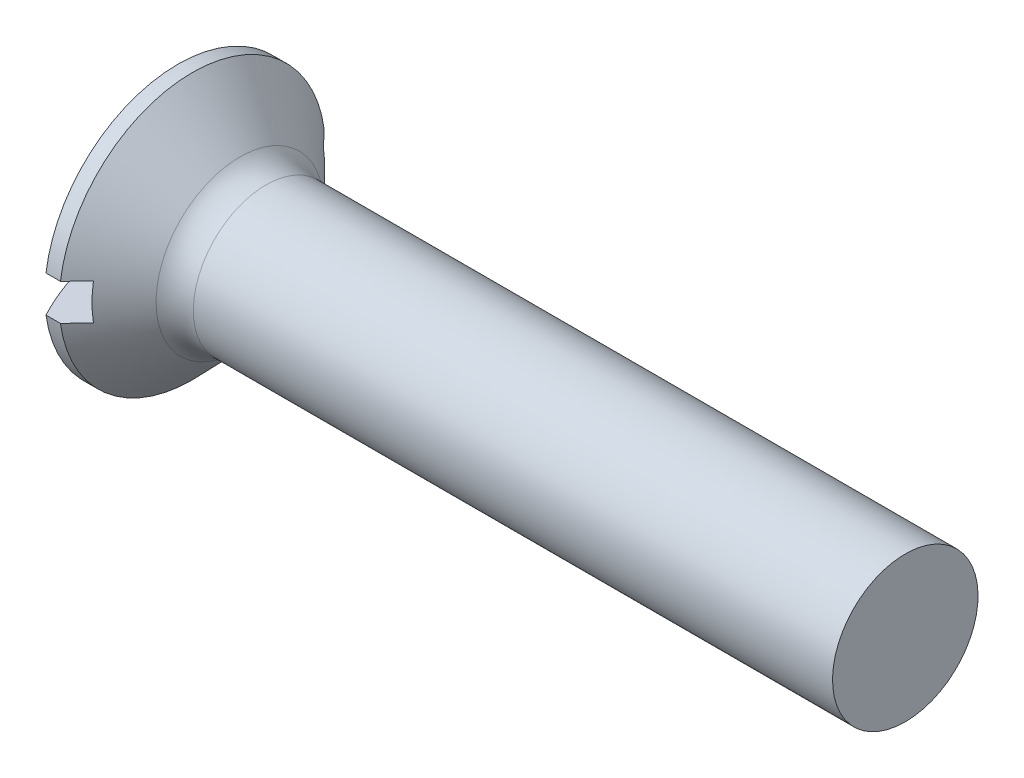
SolidWorks part; units mm, degrees
ref_plane "Front Plane" through (0, 0, 0) normal (0, 0, 1) x (1, 0, 0)
ref_plane "Top Plane" through (0, 0, 0) normal (0, 1, 0) x (1, 0, 0)
ref_plane "Right Plane" through (0, 0, 0) normal (1, 0, 0) x (0, 0, -1)
sketch "BodySke" plane through (0, 0, 0) normal (0, 0, 1) x (1, 0, 0)
  line L0 (2.3, 0) -> (111.3824, 0) construction
  line L1 (2.3, 0) -> (2.3, 9.15) construction
  line L2 (2.3, 9.15) -> (3.2924, 9.15)
  line L3 (3.2924, 9.15) -> (7.3, 5)
  line L4 (7.3, 5) -> (52.3, 5)
  line L5 (52.3, 5) -> (52.3, 0)
  line L6 (8.8, 8.824) -> (8.8, -5.8939) construction
  line L7 (2.3, 0) -> (52.3, 0)
  line L8 (14.3, 8.824) -> (14.3, -4.958) construction
  line L9 (2.3, -9.15) -> (3.2924, -9.15) construction
  line L10 (3.2924, -9.15) -> (7.3, -5) construction
  line L11 (7.3, -5) -> (52.3, -5) construction
  line L12 (2.3, 0) -> (-13.4753, 0) construction
  line L13 (0, 0) -> (0, 11.6167) construction
  line L14 (2.3, 0) -> (0, 0)
  arc A0 (0, 0) -> (2.3, 9.15) centre (19.3505, 0) cw
  point P10 (52.3, 4.172)
  dimension "Diameter" = 10
  dimension "Head_dia" = 18.3
  dimension "Length" = 50
  dimension "Advance" = 1.5
  dimension "Thread_minor" = 8.344
  dimension "Thread_length" = 38
  dimension "Head_angle" = 92
  dimension "Side_height" = 5
  dimension "Oval_height" = 2.3
revolve "BaseBody" add sketch "BodySke" angle 360 about L0
fillet "Fillet1" radius 2.5 1 edges at (7.3, -5, 0)
sketch "SlotSke" plane through (0, 0, 0) normal (1, 0, 0) x (0, 0, -1)
  line L1 (-9.15, 1.25) -> (9.15, 1.25)
  line L2 (-9.15, 1.25) -> (-9.15, -1.25)
  line L3 (-9.15, -1.25) -> (9.15, -1.25)
  line L4 (9.15, 1.25) -> (9.15, -1.25)
  dimension "D1" = 18.3
  dimension "D2" = 9.15
  dimension "D3" = 1.25
  dimension "Slot_width" = 2.5
extrude "Slot" cut sketch "SlotSke" along normal blind 4.4
sketch "ThdSchSke" plane through (0, 0, 0) normal (0, 0, 1) x (1, 0, 0)
  line L0 (0, 0) -> (55.1256, 0) construction
  line L1 (2.3, 0) -> (111.3824, 0) construction
  line L2 (51.822, 5) -> (51.822, 5.9561)
  line L3 (51.822, 5.9561) -> (52.778, 5.9561)
  line L4 (52.778, 5.9561) -> (52.778, 5)
  line L5 (52.778, 5) -> (52.3, 4.172)
  line L6 (52.3, 4.172) -> (51.822, 5)
  line L7 (7.3, 5) -> (52.3, 5) construction
  line L13 (52.3, 5) -> (52.3, 0) construction
revolve "ThreadSchematic" [suppressed] cut sketch "ThdSchSke" angle 360 about L0
pattern_linear "ThdSchPat" [suppressed] count 26 along (1, 0, 0)
equation "\"Thread_minor@ThreadCosmetic\" = \"Thread_minor@BodySke\""
equation "\"Thread_length@ThreadCosmetic\" = \"Thread_length@BodySke\""
equation "\"D1@SlotSke\" = \"Head_dia@BodySke\""
equation "\"D2@SlotSke\" = \"D1@SlotSke\" / 2"
equation "\"D3@SlotSke\" = \"Slot_width@SlotSke\" / 2"
equation "\"Advance@ThdSchPat\" = \"Advance@BodySke\""
equation "\"D1@ThdSchPat\" =  int( \"Thread_length@BodySke\" / \"Advance@ThdSchPat\" )  + 1"
